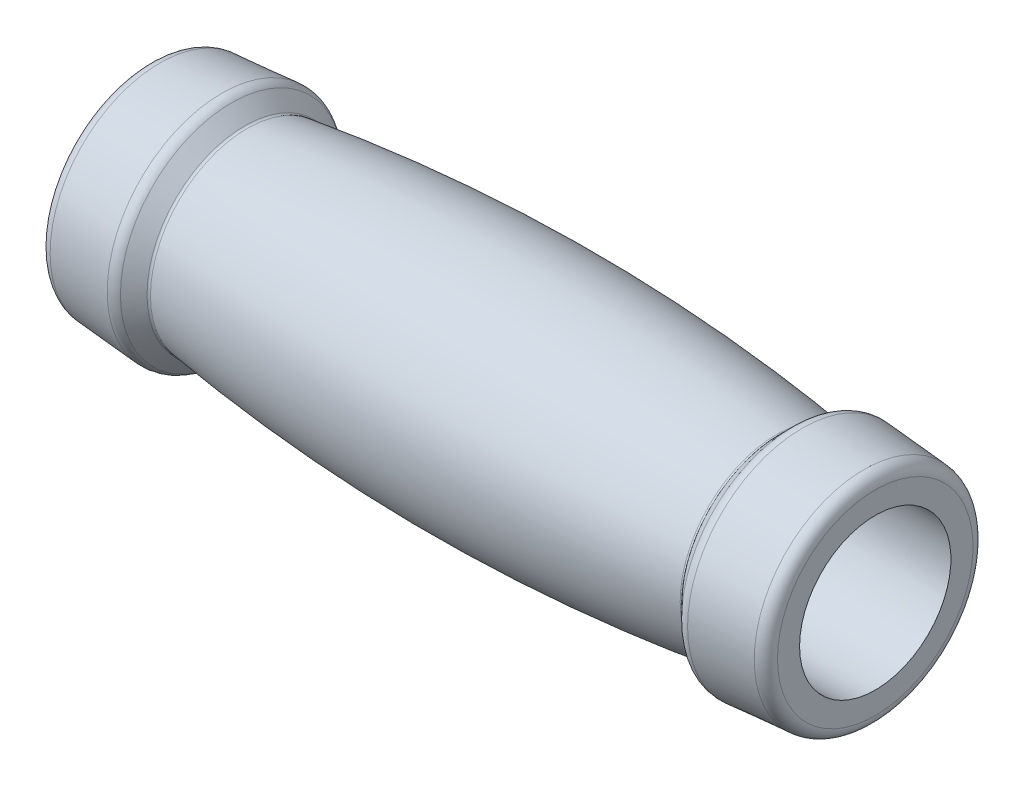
SolidWorks part; units mm, degrees
ref_plane "Plan de face" through (0, 0, 0) normal (0, 0, 1) x (1, 0, 0)
ref_plane "Plan de dessus" through (0, 0, 0) normal (0, 1, 0) x (1, 0, 0)
ref_plane "Plan de droite" through (0, 0, 0) normal (1, 0, 0) x (0, 0, -1)
sketch "Esquisse1" plane through (0, 0, 0) normal (0, 0, 1) x (1, 0, 0)
  line L0 (0, 0) -> (61.7593, 0) construction
  line L1 (0, 0) -> (0, 33.7114) construction
  line L2 (-60, 12.5) -> (60, 12.5)
  line L3 (60, 12.5) -> (60, 16.1479)
  line L4 (58.1534, 18.142) -> (47.9299, 18.9285)
  line L5 (46.3475, 18.3337) -> (44.1765, 16.1166)
  line L6 (47, 19) -> (0, 19) construction
  line L7 (-46.3475, 18.3337) -> (-44.1765, 16.1166)
  line L8 (-58.1534, 18.142) -> (-47.9299, 18.9285)
  line L9 (-60, 12.5) -> (-60, 16.1479)
  arc A0 (43.7504, 15.9712) -> (-43.7504, 15.9712) centre (0, -298.4961) ccw
  arc A1 (60, 16.1479) -> (58.1534, 18.142) centre (58, 16.1479) ccw
  arc A2 (47.9299, 18.9285) -> (46.3475, 18.3337) centre (47.7765, 16.9344) ccw
  arc A3 (44.1765, 16.1166) -> (43.7504, 15.9712) centre (43.8193, 16.4664) cw
  arc A4 (-44.1765, 16.1166) -> (-43.7504, 15.9712) centre (-43.8193, 16.4664) ccw
  arc A5 (-47.9299, 18.9285) -> (-46.3475, 18.3337) centre (-47.7765, 16.9344) cw
  arc A6 (-60, 16.1479) -> (-58.1534, 18.142) centre (-58, 16.1479) cw
  point P3 (-44, 15.9364)
  point P13 (60, 18)
  point P19 (44, 15.9364)
  point P30 (0, 12.5)
  point P31 (-60, 18)
  dimension "D9" = 2
  dimension "D10" = 0.5
  dimension "D1" = 60
  dimension "D2" = 13
  dimension "D3" = 18
  dimension "D4" = 25
  dimension "D5" = 19
  dimension "D6" = 3
  dimension "D7" = 31.8727
  dimension "D8" = 50
revolve "Révolution1" add sketch "Esquisse1" angle 360 about L0
